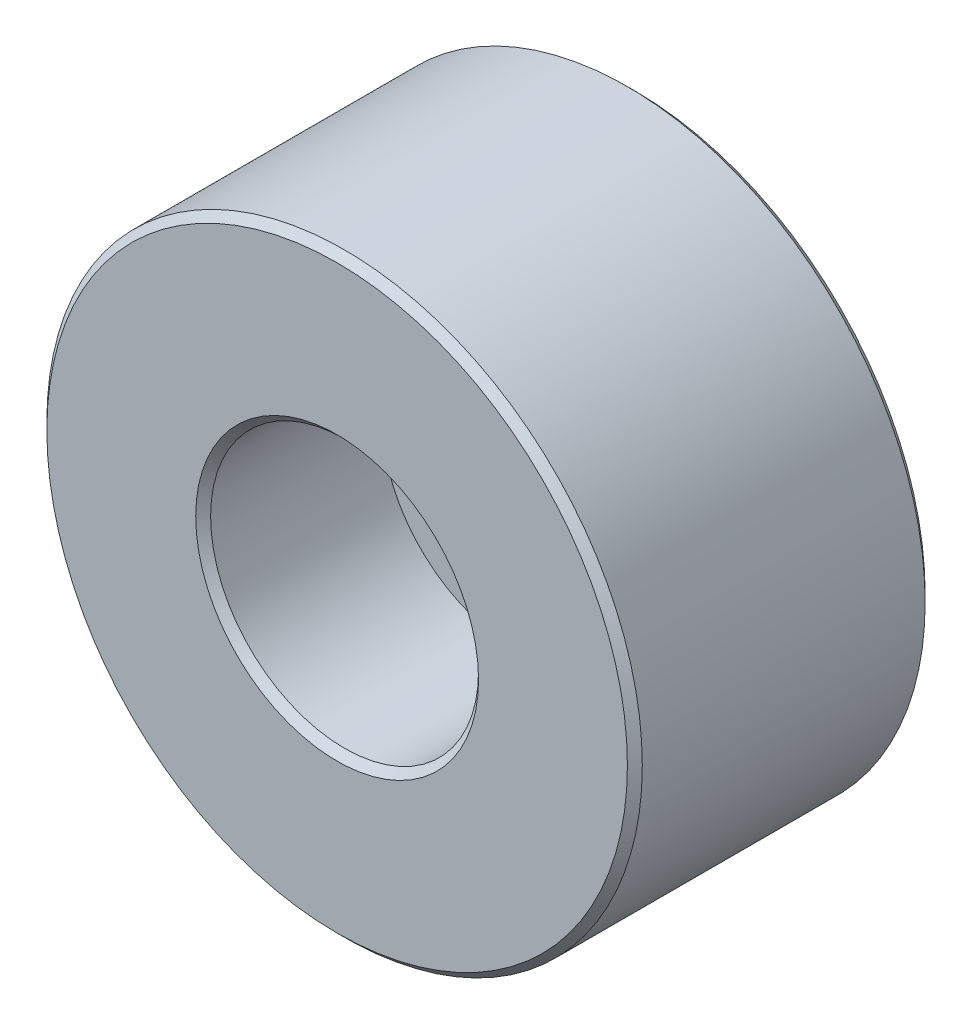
SolidWorks part; units mm, degrees
ref_plane "Plan1" through (0, 0, 0) normal (0, 0, 1) x (1, 0, 0)
ref_plane "Plan2" through (0, 0, 0) normal (0, 1, 0) x (1, 0, 0)
ref_plane "Plan3" through (0, 0, 0) normal (1, 0, 0) x (0, 0, -1)
ref_plane "Plan4" through (0, -185.0347, 0) normal (0, -1, 0) x (1, 0, 0)
sketch "Esquisse1" plane through (0, -185.0347, 0) normal (0, -1, 0) x (1, 0, 0)
  line L0 (20, 20) -> (9, 20)
  line L1 (9, 20) -> (9, 8)
  line L2 (9, 8) -> (5.5, 8)
  line L3 (5.5, 8) -> (5.5, -6)
  line L4 (5.5, -6) -> (9, -6)
  line L5 (9, -6) -> (9, 0)
  line L6 (9, 0) -> (20, 0)
  line L7 (20, 0) -> (20, 20)
  line L8 (0, 20) -> (0, -4) construction
  dimension "D1" = 5.5
  dimension "D2" = 9
  dimension "P" = 6
  dimension "D5" = 20
  dimension "D6" = 12
  dimension "D" = 20
revolve "Base-Révolution" add sketch "Esquisse1" angle 360 about L8
chamfer "Chanfrein1" distance 0.5 angle 45 4 edges at (-20, -185.0347, 0) (-9, -185.0347, -6) (-9, -185.0347, 20) (-20, -185.0347, 20)
